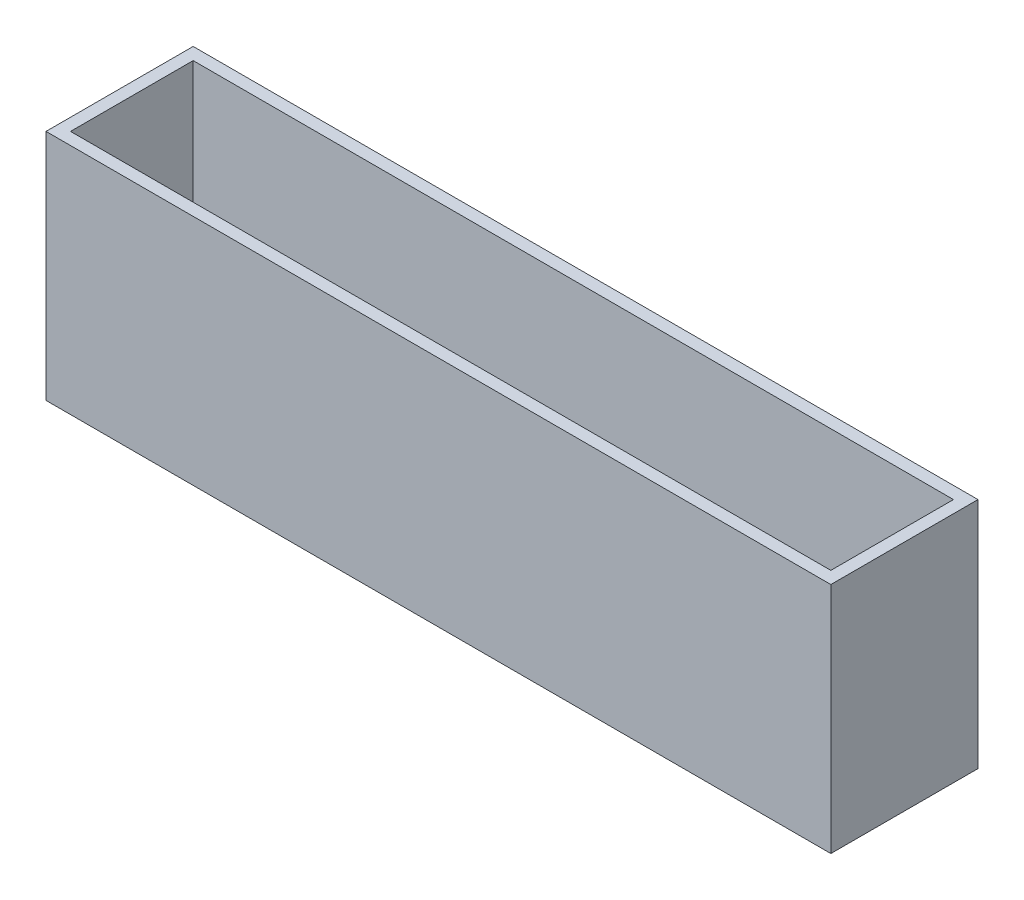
SolidWorks part; units mm, degrees
ref_plane "Front" through (0, 0, 0) normal (0, 0, 1) x (1, 0, 0)
ref_plane "Top" through (0, 0, 0) normal (0, 1, 0) x (1, 0, 0)
ref_plane "Right" through (0, 0, 0) normal (1, 0, 0) x (0, 0, -1)
sketch "Sketch1" plane through (0, 0, 0) normal (0, 1, 0) x (1, 0, 0)
  line L0 (12.7, -38.1) -> (12.7, 38.1) construction
  line L1 (203.2, 38.1) -> (-203.2, 38.1)
  line L2 (203.2, 38.1) -> (203.2, -38.1)
  line L3 (203.2, -38.1) -> (-203.2, -38.1)
  line L4 (-203.2, 38.1) -> (-203.2, -38.1)
  line L6 (-152.4, 4.7625) -> (-17.4625, 4.7625)
  line L7 (-152.4, -4.7625) -> (17.4625, -4.7625)
  line L8 (-152.4, -4.7625) -> (17.4625, -4.7625)
  line L9 (-17.4625, 4.7625) -> (152.4, 4.7625)
  line L10 (152.4, -4.7625) -> (17.4625, -4.7625)
  arc A3 (152.4, -4.7625) -> (152.4, 4.7625) centre (152.4, 0) ccw
  arc A4 (-152.4, 4.7625) -> (-152.4, -4.7625) centre (-152.4, 0) ccw
extrude "Extrude2" add sketch "Sketch1" along normal blind 12.7
sketch "Sketch2" plane through (0, 0, 38.1) normal (0, 0, 1) x (1, 0, 0)
  line L0 (203.2, 12.7) -> (203.2, 120.65)
  line L1 (203.2, 120.65) -> (-203.2, 120.65)
  line L2 (-203.2, 120.65) -> (-203.2, 12.7)
  line L7 (-203.2, 0) -> (203.2, 0)
  line L8 (203.2, 0) -> (203.2, 12.7)
  line L9 (203.2, 12.7) -> (-203.2, 12.7)
  line L10 (-203.2, 12.7) -> (-203.2, 0)
  line L13 (203.2, 12.7) -> (-203.2, 12.7)
  dimension "D1" = 0
extrude "Extrude3" add sketch "Sketch2" against normal blind 6.35
mirror "Mirror2" about plane through (0, 0, 0) normal (0, 0, 1) of "Extrude3"
sketch "Sketch3" plane through (203.2, 0, 0) normal (1, 0, 0) x (0, 0, -1)
  line L0 (31.75, 120.65) -> (-31.75, 120.65)
  line L1 (-31.75, 120.65) -> (-31.75, 12.7)
  line L2 (-31.75, 12.7) -> (31.75, 12.7)
  line L3 (31.75, 12.7) -> (31.75, 120.65)
extrude "Extrude4" add sketch "Sketch3" against normal blind 6.35
mirror "Mirror3" about plane through (0, 0, 0) normal (1, 0, 0) of "Extrude4"
sketch "Sketch4" plane through (0, 0, 0) normal (0, -1, 0) x (1, 0, 0)
  line L10 (196.7323, 31.7474) -> (-196.7323, 31.7474)
  line L11 (196.7323, 31.7474) -> (196.7323, -31.7474)
  line L12 (196.7323, -31.7474) -> (-196.7323, -31.7474)
  line L13 (-196.7323, 31.7474) -> (-196.7323, -31.7474)
extrude "Cut-Extrude1" cut sketch "Sketch4" against normal blind 6.35
